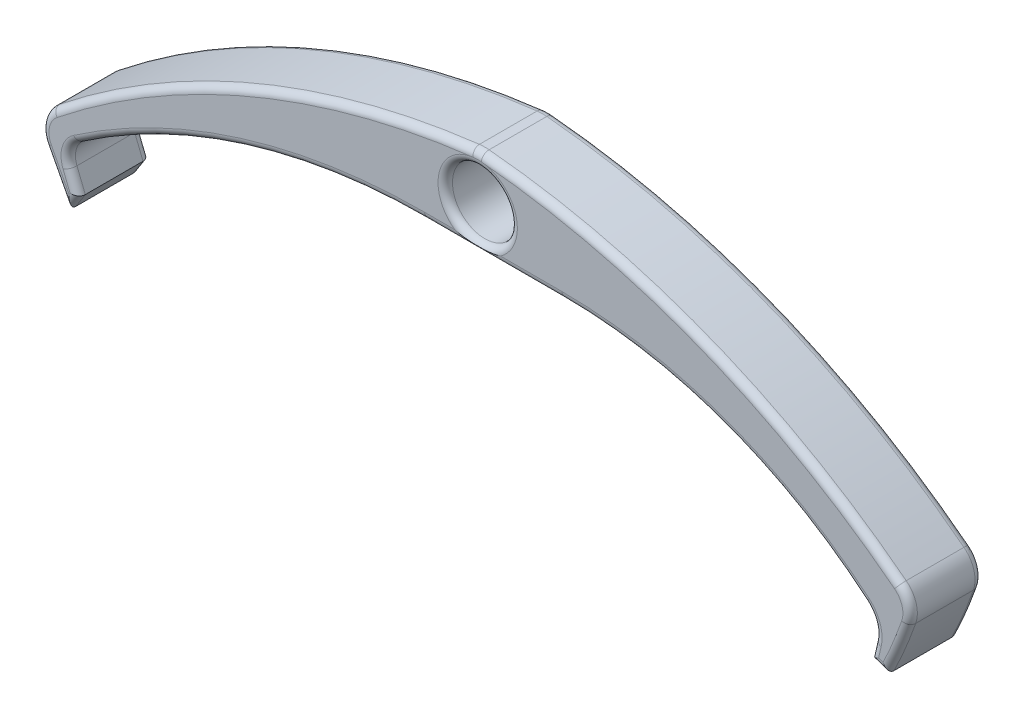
SolidWorks part; units mm, degrees
ref_plane "Спереди" through (0, 0, 0) normal (0, 0, 1) x (1, 0, 0)
ref_plane "Сверху" through (0, 0, 0) normal (0, 1, 0) x (1, 0, 0)
ref_plane "Справа" through (0, 0, 0) normal (1, 0, 0) x (0, 0, -1)
sketch "Эскиз1" plane through (0, 0, 0) normal (0, 0, 1) x (1, 0, 0)
  line L0 (0, 6.5) -> (0, -28) construction
  line L1 (-55.4, 6.5) -> (-55.4, -28) construction
  line L2 (54.4, 6.5) -> (54.4, -28) construction
  line L3 (-56.74, 6.5) -> (-56.74, -29) construction
  line L4 (56.7147, 6.5) -> (56.7147, -28) construction
  line L5 (-53.7688, -96) -> (53.7688, -96) construction
  line L6 (-60.44, 6.5) -> (-60.44, -28) construction
  line L7 (-60.44, -28) -> (58.86, -28) construction
  line L8 (56.7147, -28) -> (54.4, -27.2)
  line L9 (-60.44, -29) -> (58.86, -29) construction
  line L10 (-56.74, -29) -> (-55.4, -26.9)
  line L11 (-55.4, -26.9) -> (-56.5543, -24.0141)
  line L12 (54.4, -27.2) -> (54.9541, -24.7998)
  line L13 (-7.355, -5.5) -> (11.6937, -5.5)
  line L15 (-56.74, -29) -> (-59.9848, -22.7932)
  circle A0 centre (0, 0) radius 4.5
  arc A1 (0.5801, 6.4741) -> (-0.7628, 6.4551) centre (0, 0) ccw
  arc A2 (54.9541, -24.7998) -> (53.6378, -20.8443) centre (51.0566, -23.9) ccw
  arc A3 (53.6378, -20.8443) -> (11.6937, -5.5) centre (11.6937, -70.5) ccw
  arc A4 (59.7264, -20.8165) -> (58.409, -16.3458) centre (55.9492, -19.5) ccw
  arc A5 (58.409, -16.3458) -> (0.5801, 6.4741) centre (-9.2368, -103.087) ccw
  arc A6 (-55.4669, -20.4268) -> (-56.5543, -24.0141) centre (-53.7688, -22.9) ccw
  arc A7 (-7.355, -5.5) -> (-55.4669, -20.4268) centre (-7.355, -90.5) ccw
  arc A8 (-58.9327, -17.8118) -> (-59.9848, -22.7932) centre (-56.44, -20.9401) ccw
  arc A9 (-0.7628, 6.4551) -> (-58.9327, -17.8118) centre (12.7337, -107.7502) ccw
  arc A10 (56.7147, -28) -> (59.7264, -20.8165) centre (0, 0) ccw
  circle A11 centre (0, -96) radius 90.5 construction
  dimension "D1" = 9
  dimension "D2" = 13
  dimension "D16" = 8
  dimension "D18" = 85
  dimension "D20" = 220
  dimension "D22" = 6
  dimension "D25" = 230
  dimension "D26" = 126.5
  dimension "D6" = 8.5
  dimension "D19" = 181
  dimension "D15" = 65
  dimension "D3" = 55.4
  dimension "D4" = 54.4
  dimension "D5" = 1.34
  dimension "D7" = 96
  dimension "D8" = 3.7
  dimension "D9" = 28
  dimension "D10" = 0.8
  dimension "D11" = 29
  dimension "D12" = 2.1
  dimension "D13" = 21.8
  dimension "D14" = 13
  dimension "D17" = 23.9
  dimension "D21" = 27.6
  dimension "D23" = 22.9
extrude "Бобышка-Вытянуть1" add sketch "Эскиз1" along normal blind 10
fillet "Скругление1" radius 1 34 edges at (4.5, 0, 0) (-60.3537, -20.1135, 0) (-58.3624, -25.8966, 0) (-56.07, -27.95, 0) (-55.9771, -25.4571, 0) (-56.6398, -22.0297, 0) (-32.5421, -9.3174, 0) (34.0251, -9.4565, 0) (54.852, -22.637, 0) (54.6771, -25.9999, 0) (55.5574, -27.6, 0) (59.7861, -18.3694, 0) (31.1402, -0.7655, 0) (-0.0919, 6.4994, 0) (-31.5427, -1.6154, 0) (4.5, 0, 10) (-0.0919, 6.4994, 10) (31.1402, -0.7655, 10) (59.7861, -18.3694, 10) (55.5574, -27.6, 10) (54.6771, -25.9999, 10) (54.852, -22.637, 10) (34.0251, -9.4565, 10) (-32.5421, -9.3174, 10) (-56.6398, -22.0297, 10) (-55.9771, -25.4571, 10) (-56.07, -27.95, 10) (-58.3624, -25.8966, 10) (-60.3537, -20.1135, 10) (-31.5427, -1.6154, 10) (58.3312, -24.4546, 0) (58.3312, -24.4546, 10) (2.1693, -5.5, 0) (2.1693, -5.5, 10)
